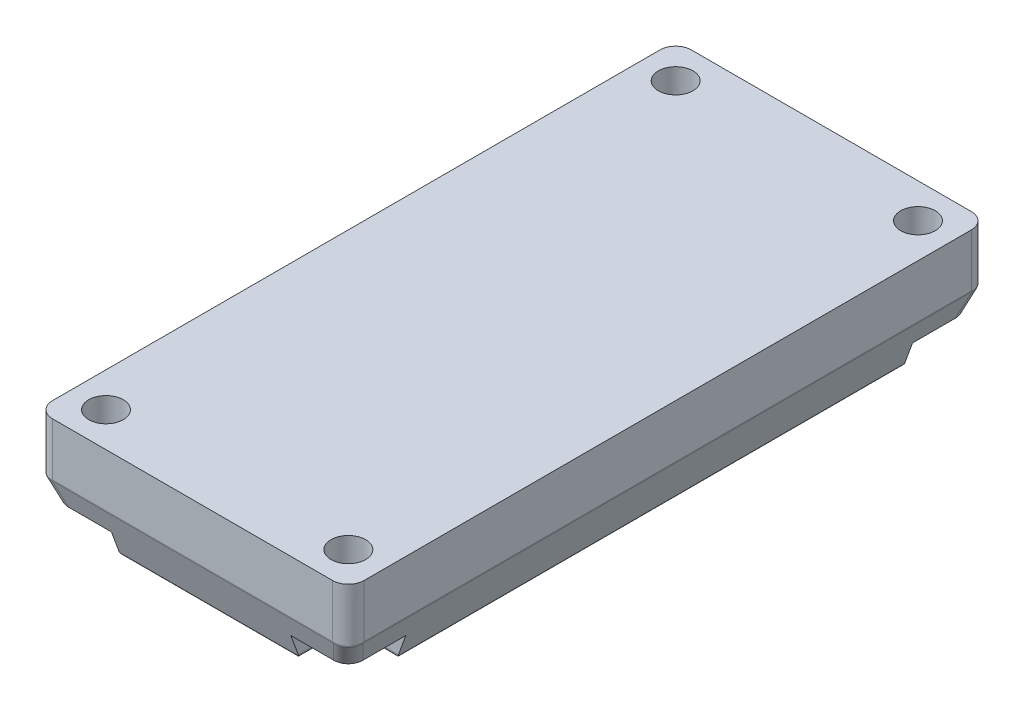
SolidWorks part; units mm, degrees
ref_plane "Front Plane" through (0, 0, 0) normal (0, 0, 1) x (1, 0, 0)
ref_plane "Top Plane" through (0, 0, 0) normal (0, 1, 0) x (1, 0, 0)
ref_plane "Right Plane" through (0, 0, 0) normal (1, 0, 0) x (0, 0, -1)
sketch "Sketch1" plane through (0, 0, 0) normal (0, 1, 0) x (1, 0, 0)
  line L1 (-9.9, 20.3) -> (9.9, 20.3)
  line L2 (-9.9, 20.3) -> (-9.9, -20.3)
  line L3 (-9.9, -20.3) -> (9.9, -20.3)
  line L4 (9.9, 20.3) -> (9.9, -20.3)
  line L5 (-9.9, 20.3) -> (9.9, -20.3) construction
  line L6 (-9.9, -20.3) -> (9.9, 20.3) construction
  point P0 (0, 0)
  dimension "D1" = 19.8
  dimension "D2" = 40.6
extrude "Boss-Extrude1" add sketch "Sketch1" against normal blind 6.4
sketch "Sketch2" plane through (0, -6.4, 0) normal (0, -1, 0) x (-1, 0, 0)
  line L0 (5.7, -17.9) -> (5.7, -20.3)
  line L1 (9.9, -20.3) -> (-9.9, -20.3) construction
  line L2 (7.5, -16.1) -> (9.9, -16.1)
  line L3 (9.9, 20.3) -> (9.9, -20.3) construction
  line L4 (5.7, -20.3) -> (9.9, -20.3)
  line L5 (9.9, -20.3) -> (9.9, -16.1)
  arc A0 (7.5, -16.1) -> (5.7, -17.9) centre (7.5, -17.9) ccw
  dimension "D3" = 3.6
  dimension "D1" = 4.2
  dimension "D2" = 4.2
extrude "Cut-Extrude1" cut sketch "Sketch2" against normal blind 1.5
hole_wizard "M2 Clearance Hole1" positions "Sketch8" profile "Sketch7" hole size "M2" standard "ANSI Metric"
sketch "Sketch8" plane through (0, -4.9, 0) normal (0, -1, 0) x (-1, 0, 0)
  line L0 (9.9, -20.3) -> (9.9, -16.1) construction
  line L1 (5.7, -20.3) -> (9.9, -20.3) construction
  point P0 (7.7, -18.1)
  dimension "D1" = 2.2
  dimension "D2" = 2.2
sketch "Sketch7" plane through (-7.7, -4.9, 18.1) normal (1, 0, 0) x (0, 0, -1)
  line L0 (0, 0) -> (0, 4.9)
  line L1 (0, 4.9) -> (1.1, 4.9)
  line L2 (1.1, 4.9) -> (1.1, 0)
  line L5 (1.1, 0) -> (0, 0)
  line L11 (0, -6.35) -> (0, 107.95) construction
  dimension "Thru Hole Dia." = 2.2
  dimension "Thru Hole Depth" = 4.9
mirror "Mirror1" about plane through (0, 0, 0) normal (1, 0, 0) of "M2 Clearance Hole1", "Cut-Extrude1"
mirror "Mirror2" about plane through (0, 0, 0) normal (0, 0, 1) of "Mirror1", "Cut-Extrude1", "M2 Clearance Hole1"
sketch "Sketch3" plane through (0, 0, 0) normal (0, 0, 1) x (1, 0, 0)
  line L0 (9.9, -3.4) -> (9.9, -6.4)
  line L1 (9.9, -4.9) -> (9.9, 0) construction
  line L2 (9.9, -6.4) -> (8.8081, -6.4)
  line L3 (9.9, -6.4) -> (7.5, -6.4) construction
  line L4 (8.8081, -6.4) -> (9.9, -3.4)
  dimension "D1" = 3
  dimension "D2" = 20
extrude "Cut-Extrude2" cut sketch "Sketch3" against normal through all both and the other way through all
mirror "Mirror3" about plane through (0, 0, 0) normal (1, 0, 0) of "Cut-Extrude2"
sketch "Sketch4" plane through (0, 0, 0) normal (1, 0, 0) x (0, 0, -1)
  line L0 (20.3, -3.4) -> (19.2081, -6.4)
  line L1 (20.3, -3.4) -> (20.3, 0) construction
  line L2 (17.9, -6.4) -> (20.3, -6.4) construction
  line L3 (19.2081, -6.4) -> (20.3, -6.4)
  line L4 (20.3, -6.4) -> (20.3, -3.4)
  dimension "D1" = 3
  dimension "D2" = 20
extrude "Cut-Extrude3" cut sketch "Sketch4" against normal through all both and the other way through all
mirror "Mirror4" about plane through (0, 0, 0) normal (0, 0, 1) of "Cut-Extrude3"
fillet "Fillet1" radius 1 8 edges at (-9.627, -4.15, -20.027) (-9.9, -1.7, -20.3) (9.9, -1.7, -20.3) (9.627, -4.15, -20.027) (9.627, -4.15, 20.027) (9.9, -1.7, 20.3) (-9.9, -1.7, 20.3) (-9.627, -4.15, 20.027)
fillet "Fillet2" radius 0.2 32 edges at (-8.9293, -3.4012, 20.2996) (-9.6071, -3.4659, 20.0071) (-9.8996, -3.4012, 19.3293) (-9.9, -3.4, 0) (-9.8996, -3.4012, -19.3293) (-9.6071, -3.4659, -20.0071) (-8.9293, -3.4012, -20.2996) (0, -3.4, -20.3) (8.9293, -3.4012, -20.2996) (9.6071, -3.4659, -20.0071) (9.8996, -3.4012, -19.3293) (9.9, -3.4, 0) (9.8996, -3.4012, 19.3293) (9.6071, -3.4659, 20.0071) (8.9293, -3.4012, 20.2996) (5.7, -6.4, 18.554) (6.2272, -6.4, 16.6272) (8.154, -6.4, 16.1) (8.8081, -6.4, 0) (8.154, -6.4, -16.1) (6.2272, -6.4, -16.6272) (5.7, -6.4, -18.554) (0, -6.4, -19.2081) (-5.7, -6.4, -18.554) (-6.2272, -6.4, -16.6272) (-8.154, -6.4, -16.1) (-8.8081, -6.4, 0) (-8.154, -6.4, 16.1) (-6.2272, -6.4, 16.6272) (-5.7, -6.4, 18.554) (0, -6.4, 19.2081) (0, -3.4, 20.3)
